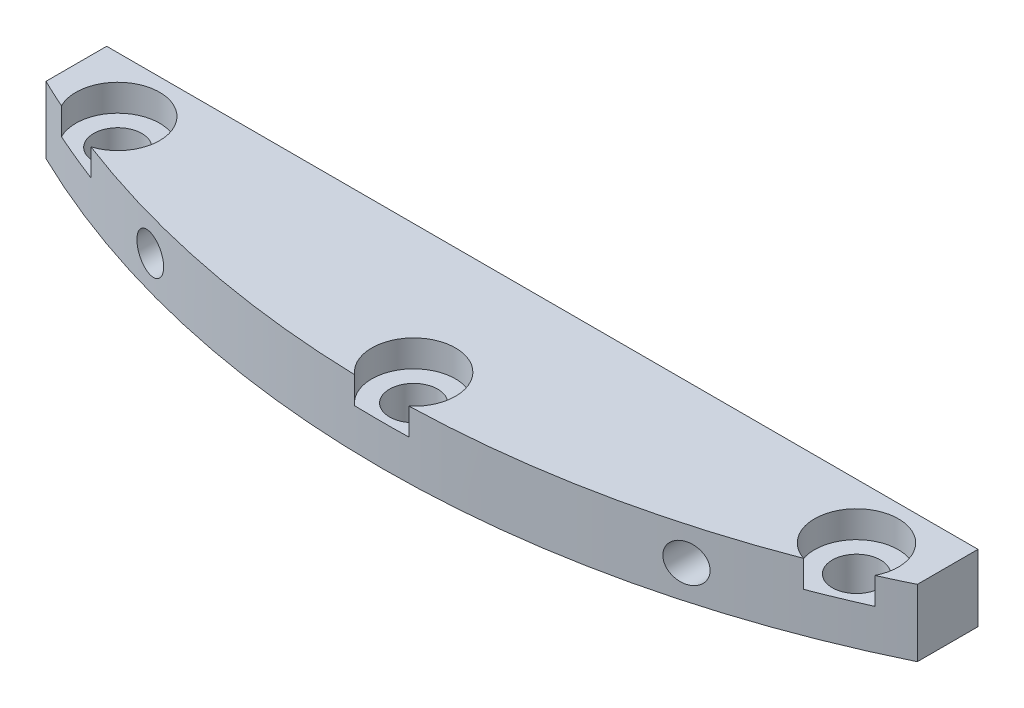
SolidWorks part; units mm, degrees
ref_plane "Front Plane" through (0, 0, 0) normal (0, 0, 1) x (1, 0, 0)
ref_plane "Top Plane" through (0, 0, 0) normal (0, 1, 0) x (1, 0, 0)
ref_plane "Right Plane" through (0, 0, 0) normal (1, 0, 0) x (0, 0, -1)
sketch "Sketch1" plane through (0, 0, 0) normal (0, 1, 0) x (1, 0, 0)
  line L0 (-41.275, -79.248) -> (-41.275, -84.9962)
  line L1 (0, 0) -> (0, -103.3133) construction
  line L2 (41.275, -79.248) -> (41.275, -84.9962)
  line L3 (41.275, -79.248) -> (-41.275, -79.248)
  line L4 (0, 0) -> (-34.9926, -84.4795) construction
  arc A0 (-41.275, -84.9962) -> (41.275, -84.9962) centre (0, 0) ccw
  circle A1 centre (34.9926, -84.4795) radius 2.286
  circle A3 centre (-34.9926, -84.4795) radius 2.286
  circle A9 centre (0, -91.44) radius 2.286
  point P5 (0, -79.248)
  dimension "D4" = 91.44
  dimension "D2" = 91.44
  dimension "D3" = 4.572
  dimension "D5" = 12.192
  dimension "D6" = 4.572
  dimension "D7" = 82.55
  dimension "D8" = 94.488
  dimension "D14" = 22.5
extrude "Extrude1" add sketch "Sketch1" along normal blind 6.35
sketch "Sketch2" plane through (0, 0, 79.248) normal (0, 0, -1) x (-1, 0, 0)
  line L0 (-41.275, 3.175) -> (41.275, 3.175) construction
  line L1 (-41.275, 6.35) -> (-41.275, 0) construction
  line L2 (41.275, 6.35) -> (41.275, 0) construction
  line L3 (0, 6.35) -> (0, 0) construction
  line L4 (-41.275, 6.35) -> (41.275, 6.35) construction
  line L5 (-41.275, 0) -> (41.275, 0) construction
  circle A0 centre (-25.4, 3.175) radius 1.7526
  circle A1 centre (25.4, 3.175) radius 1.7526
  dimension "D1" = 3.5052
  dimension "D2" = 50.8
extrude "Cut-Extrude1" cut sketch "Sketch2" against normal through all
sketch "Sketch3" plane through (0, 6.35, 0) normal (0, 1, 0) x (1, 0, 0)
  circle A0 centre (34.9926, -84.4795) radius 3.9687
  circle A1 centre (0, -91.44) radius 3.9687
  circle A2 centre (-34.9926, -84.4795) radius 3.9688
extrude "Cut-Extrude2" cut sketch "Sketch3" against normal blind 2.54
